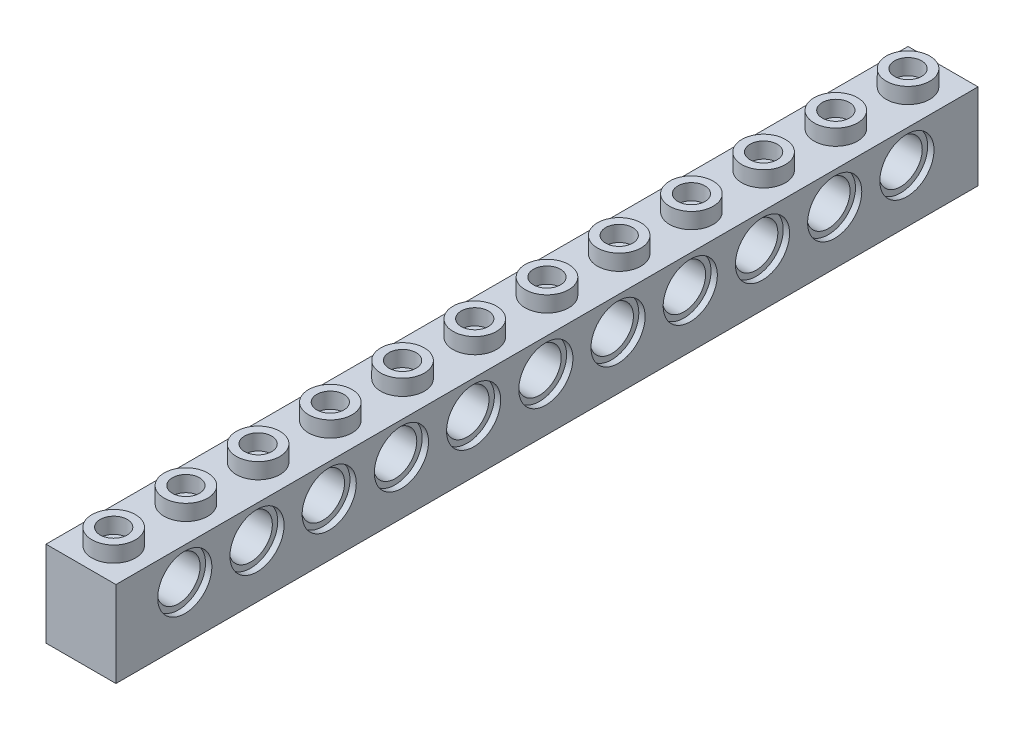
SolidWorks part; units mm, degrees
ref_plane "Front Plane" through (0, 0, 0) normal (0, 0, 1) x (1, 0, 0)
ref_plane "Top Plane" through (0, 0, 0) normal (0, 1, 0) x (1, 0, 0)
ref_plane "Right Plane" through (0, 0, 0) normal (1, 0, 0) x (0, 0, -1)
sketch "Sketch1" plane through (0, 0, 0) normal (0, 0, 1) x (1, 0, 0)
  line L1 (3.875, -4.75) -> (-3.875, -4.75)
  line L2 (3.875, -4.75) -> (3.875, 4.75)
  line L3 (3.875, 4.75) -> (-3.875, 4.75)
  line L4 (-3.875, -4.75) -> (-3.875, 4.75)
  line L5 (3.875, -4.75) -> (-3.875, 4.75) construction
  line L6 (3.875, 4.75) -> (-3.875, -4.75) construction
  point P0 (0, 0)
  dimension "D1" = 7.75
  dimension "D2" = 9.5
extrude "Boss-Extrude1" add sketch "Sketch1" along normal blind 95.5
sketch "Sketch2" plane through (0, 4.75, 0) normal (0, 1, 0) x (-1, 0, 0)
  line L0 (0, 0) -> (0, 100.391) construction
  line L1 (-3.875, 0) -> (3.875, 0) construction
  circle A0 centre (0, 3.875) radius 2.415
  circle A1 centre (0, 3.875) radius 1.5
  dimension "D1" = 3
  dimension "D2" = 4.83
  dimension "D3" = 3.875
extrude "Boss-Extrude2" add sketch "Sketch2" along normal blind 1.75
sketch "Sketch3" plane through (0, 4.75, 0) normal (0, 1, 0) x (-1, 0, 0)
  line L0 (0, 0) -> (0, 103.7136) construction
pattern_linear "LPattern1" count 12 spacing 8 along (0, 0, 1) of "Boss-Extrude2"
sketch "Sketch4" plane through (0, -4.75, 0) normal (0, -1, 0) x (1, 0, 0)
  line L14 (-2.425, 1.45) -> (2.425, 1.45)
  line L15 (2.425, 1.45) -> (2.425, 94.05)
  line L16 (-2.425, 94.05) -> (-2.425, 1.45)
  line L17 (2.425, 94.05) -> (-2.425, 94.05)
  line L18 (-2.425, 1.45) -> (2.425, 1.45)
  line L19 (2.425, 1.45) -> (2.425, 94.05)
  line L20 (-2.425, 94.05) -> (-2.425, 1.45)
  line L21 (2.425, 94.05) -> (-2.425, 94.05)
  dimension "D1" = 1.45
extrude "Cut-Extrude1" cut sketch "Sketch4" against normal blind 1.75
sketch "Sketch5" plane through (0, -3, 0) normal (0, -1, 0) x (1, 0, 0)
  line L0 (0, 95.5) -> (0, 77.0867) construction
  line L1 (-3.875, 95.5) -> (3.875, 95.5) construction
  circle A0 centre (0, 87.9) radius 1.5
  dimension "D1" = 3
  dimension "D2" = 7.6
extrude "Boss-Extrude3" add sketch "Sketch5" along normal blind 1.75
sketch "Sketch6" plane through (0, -3, 0) normal (0, -1, 0) x (1, 0, 0)
  line L0 (0, 95.5) -> (0, -4.9949) construction
  line L1 (-3.875, 95.5) -> (3.875, 95.5) construction
pattern_linear "LPattern2" count 11 spacing 8 along (0, 0, -1) of "Boss-Extrude3"
sketch "Sketch7" plane through (-3.875, 0, 0) normal (-1, 0, 0) x (0, 0, 1)
  line L0 (0, 1.15) -> (95.5, 1.15) construction
  line L1 (0, 4.75) -> (0, -4.75) construction
  line L2 (95.5, 4.75) -> (95.5, -4.75) construction
  line L3 (95.5, 4.75) -> (0, 4.75) construction
  line L4 (87.875, 7.7557) -> (87.875, -5.909) construction
  line L5 (89.46, 6.5) -> (89.46, 4.75) construction
  circle A0 centre (87.875, 1.15) radius 3
  dimension "D3" = 6
  dimension "D1" = 3.6
  dimension "D2" = 1.585
extrude "Cut-Extrude2" cut sketch "Sketch7" against normal blind 0.7
sketch "Sketch8" plane through (3.875, 0, 0) normal (1, 0, 0) x (0, 0, -1)
  circle A0 centre (-87.875, 1.15) radius 3
  dimension "D1" = 6
extrude "Cut-Extrude3" cut sketch "Sketch8" against normal blind 0.7
sketch "Sketch9" plane through (3.875, 0, 0) normal (1, 0, 0) x (0, 0, -1)
  circle A0 centre (-87.875, 1.15) radius 2.4
  dimension "D1" = 4.8
extrude "Cut-Extrude4" cut sketch "Sketch9" against normal through all
pattern_linear "LPattern3" count 11 spacing 8 along (0, 0, -1) of "Cut-Extrude4", "Cut-Extrude3", "Cut-Extrude2"
